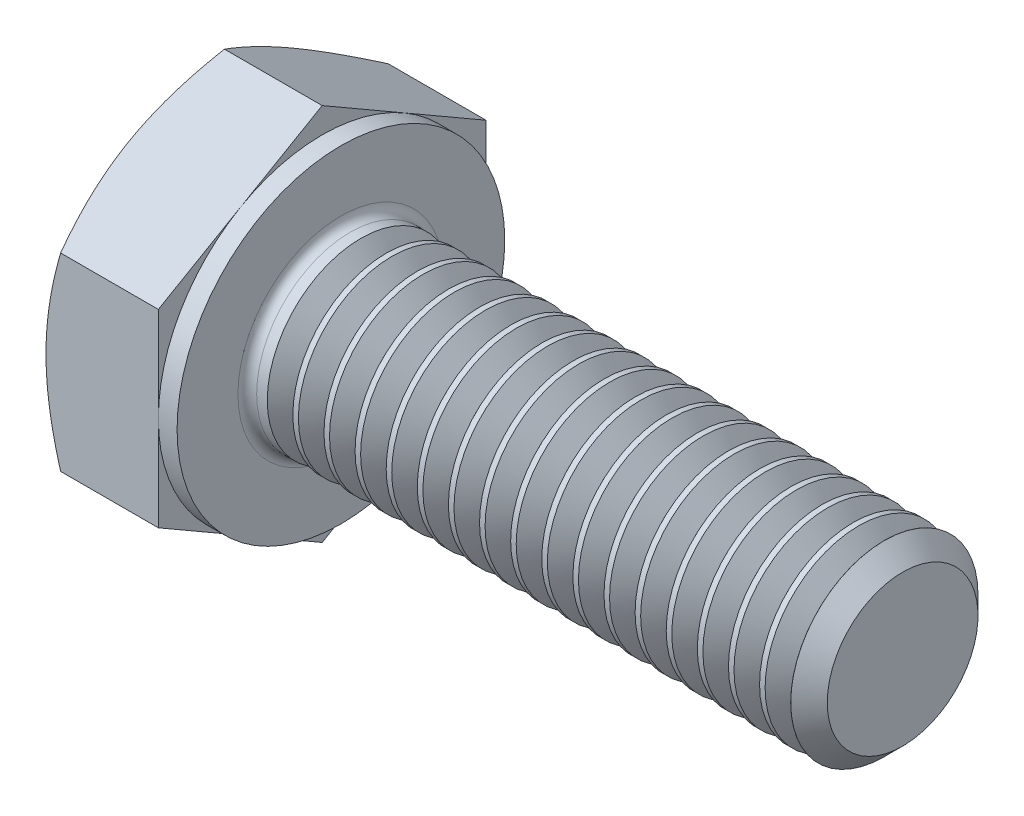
SolidWorks part; units mm, degrees
extrude "BaseHead" add sketch "Sketch1" along normal blind 2.8
sketch "Sketch1" plane through (0, 0, 0) normal (1, 0, 0) x (0, 0, -1)
  line L0 (3.5, 2.0207) -> (3.5, -2.0207)
  line L1 (-3.5, 2.0207) -> (-3.5, -2.0207)
  line L2 (3.5, -2.0207) -> (0, -4.0415)
  line L3 (0, -4.0415) -> (-3.5, -2.0207)
  line L4 (3.5, 2.0207) -> (0, 4.0415)
  line L5 (0, 4.0415) -> (-3.5, 2.0207)
revolve "HeadChamfer" cut sketch "Sketch3" angle 360 about L6
sketch "Sketch3" plane through (0, 0, 0) normal (0, 0, 1) x (1, 0, 0)
  line L0 (0, 3.5) -> (3.1994, 9.0415)
  line L1 (0, 4.0415) -> (0, 2.0207) construction
  line L2 (3.1994, 9.0415) -> (3.1994, 14.0415)
  line L3 (3.1994, 14.0415) -> (-10, 14.0415)
  line L4 (-10, 14.0415) -> (-10, 3.5)
  line L5 (-10, 3.5) -> (0, 3.5)
  line L6 (0, 0) -> (99.06, 0) construction
  line L7 (2.8, 4.0415) -> (0, 4.0415) construction
ref_plane "Plane1" through (0, 0, 0) normal (0, 0, 1) x (1, 0, 0)
ref_plane "Plane2" through (0, 0, 0) normal (0, 1, 0) x (1, 0, 0)
ref_plane "Plane3" through (0, 0, 0) normal (1, 0, 0) x (0, 0, -1)
sketch "BodySke" plane through (0, 0, 0) normal (0, 0, 1) x (1, 0, 0)
  line L0 (0, 2.0207) -> (0, -2.0207) construction
  line L1 (0, 0) -> (14.8, 0)
  line L2 (0, 0) -> (0, 2)
  line L3 (0, 2) -> (14.41, 2)
  line L4 (14.8, 0) -> (14.8, 1.61)
  line L5 (2.8, 4.0415) -> (2.8, 2.0207) construction
  line L6 (14.8, 1.61) -> (14.41, 2)
  line L7 (0, 0) -> (96.52, 0) construction
  line L8 (14.8, -1.61) -> (14.41, -2) construction
  line L9 (0, -2) -> (14.41, -2) construction
  line L10 (3.5, 15.24) -> (3.5, -1.27) construction
  line L12 (2.8, 2.0207) -> (2.8, -2.0207) construction
revolve "BaseBody" add sketch "BodySke"
fillet "HeadFillet" radius 0.2 1 edges at (2.8, 0, -2)
sketch "Sketch4" plane through (0, 0, 0) normal (0, 0, 1) x (1, 0, 0)
  line L1 (2.8, 4.0415) -> (2.8, 2.0207) construction
  line L2 (2.8, 3.5) -> (2.4, 3.5)
  line L3 (2.8, 3.5) -> (2.8, 14.0415)
  line L4 (2.8, 14.0415) -> (2.4, 14.0415)
  line L5 (0, 0) -> (95.25, 0) construction
  line L6 (0, 0) -> (96.52, 0) construction
  line L7 (2.4, 3.5) -> (2.4, 14.0415)
  line L8 (2.8, 4.0415) -> (0.3126, 4.0415) construction
revolve "BearingFace" cut sketch "Sketch4" angle 360 about L5
sketch "ThdSchSke" plane through (0, 0, 0) normal (0, 0, 1) x (1, 0, 0)
  line L0 (3.5, -1.61) -> (3.2269, -2)
  line L1 (3.5, -1.61) -> (3.7731, -2)
  line L2 (3.7731, -2) -> (3.7731, -2.5)
  line L3 (-3.175, 0) -> (5.1513, 0) construction
  line L5 (3.7731, -2.5) -> (3.2269, -2.5)
  line L6 (3.2269, -2.5) -> (3.2269, -2)
revolve "ThreadSchematic" cut sketch "ThdSchSke" angle 360 about L3
pattern_linear "ThdSchPat" count 17 spacing 0.6647 along (1, 0, 0) of "ThreadSchematic"
equation "\"D3@Sketch1\" = \"Width_flats@Sketch1\" / 2"
equation "\"D4@Sketch1\" = \"D3@Sketch1\""
equation "\"D5@Sketch1\" = \"D4@Sketch1\""
equation "\"Thread_minor@ThreadCosmetic\" = \"Minor_dia@BodySke\""
equation "\"D1@Sketch3\" = \"Width_flats@Sketch1\" / 2"
equation "\"D1@Sketch4\" = \"Width_flats@Sketch1\""
equation "\"Thread_length@ThreadCosmetic\" = \"Length@BodySke\" - \"Advance@BodySke\""
equation "\"Thread_minor@ThdSchSke\" = \"Minor_dia@BodySke\""
equation "\"Diameter@ThdSchSke\" = \"Diameter@BodySke\""
equation "\"Overcut@ThdSchSke\" = \"Diameter@BodySke\" * 1.25"
equation "\"Start@ThdSchSke\" = \"Head_ht@BaseHead\" + \"Length@BodySke\" - \"Thread_length@ThreadCosmetic\"  '---Non-countersunk---"
equation "\"Num_threads@ThdSchPat\" = int( \"Thread_length@ThreadCosmetic\" / \"Advance@BodySke\" + 0.999 )  + 1"
equation "\"Advance@ThdSchPat\" = \"Thread_length@ThreadCosmetic\" /  (\"Num_threads@ThdSchPat\" - 1) 'relax it"
equation "\"Num_threads@ThdSchPat\" = \"Num_threads@ThdSchPat\" - sgn( \"Num_threads@ThdSchPat\" - 1) '---chamfered tips only---"
